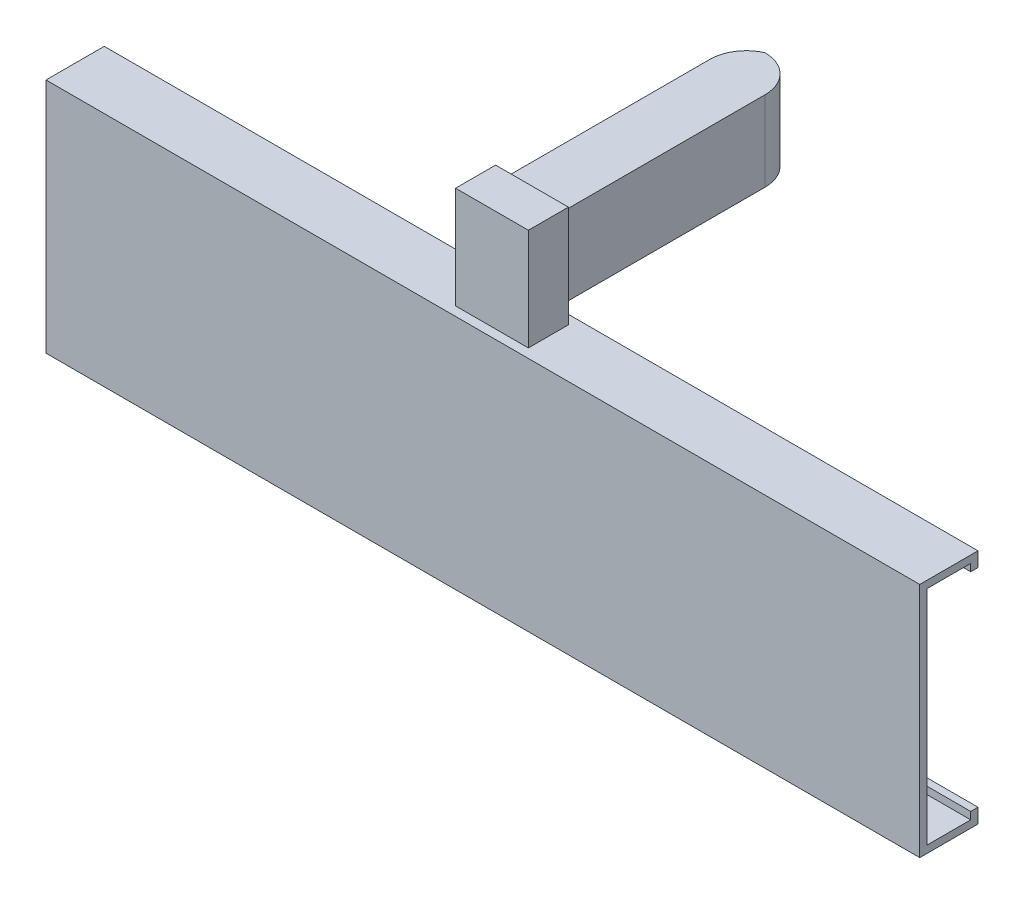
SolidWorks part; units mm, degrees
ref_plane "Front Plane" through (0, 0, 0) normal (0, 0, 1) x (1, 0, 0)
ref_plane "Top Plane" through (0, 0, 0) normal (0, 1, 0) x (1, 0, 0)
ref_plane "Right Plane" through (0, 0, 0) normal (1, 0, 0) x (0, 0, -1)
sketch "Sketch1" plane through (0, 0, 0) normal (0, 0, 1) x (1, 0, 0)
  line L1 (-60, -15.75) -> (60, -15.75)
  line L2 (-60, -15.75) -> (-60, 15.75)
  line L3 (-60, 15.75) -> (60, 15.75)
  line L4 (60, -15.75) -> (60, 15.75)
  line L5 (-60, -15.75) -> (60, 15.75) construction
  line L6 (-60, 15.75) -> (60, -15.75) construction
  point P0 (0, 0)
  dimension "D1" = 31.5
  dimension "D2" = 120
extrude "Boss-Extrude1" add sketch "Sketch1" along normal blind 1
sketch "Sketch2" plane through (0, 15.75, 0) normal (0, 1, 0) x (1, 0, 0)
  line L0 (60, -1) -> (-60, -1) construction
  line L1 (-60, 0) -> (60, 0)
  line L2 (-60, 0) -> (-60, 7)
  line L3 (-60, 7) -> (60, 7)
  line L4 (60, 0) -> (60, 7)
  line L5 (60, -1) -> (60, 0) construction
  dimension "D1" = 7
  dimension "D2" = 0
extrude "Boss-Extrude2" add sketch "Sketch2" against normal blind 1
sketch "Sketch3" plane through (0, 14.75, 0) normal (0, -1, 0) x (1, 0, 0)
  line L0 (60, 0) -> (60, -7) construction
  line L1 (-60, -7) -> (60, -7)
  line L2 (-60, -7) -> (-60, -6)
  line L3 (-60, -6) -> (60, -6)
  line L4 (60, -7) -> (60, -6)
  dimension "D1" = 1
extrude "Boss-Extrude3" add sketch "Sketch3" along normal blind 1
sketch "Sketch4" plane through (0, -15.75, 0) normal (0, -1, 0) x (1, 0, 0)
  line L1 (-60, 1) -> (60, 1)
  line L2 (-60, 1) -> (-60, -7)
  line L3 (-60, -7) -> (60, -7)
  line L4 (60, 1) -> (60, -7)
  line L8 (60, 1) -> (60, 0) construction
  dimension "D1" = 8
extrude "Boss-Extrude4" add sketch "Sketch4" along normal blind 1
sketch "Sketch6" plane through (0, -15.75, 0) normal (0, 1, 0) x (1, 0, 0)
  line L0 (60, 7) -> (60, 0) construction
  line L1 (-60, 7) -> (60, 7)
  line L2 (-60, 7) -> (-60, 6)
  line L3 (-60, 6) -> (60, 6)
  line L4 (60, 7) -> (60, 6)
  dimension "D1" = 1
extrude "Boss-Extrude5" add sketch "Sketch6" along normal blind 1
sketch "Sketch7" plane through (0, 15.75, 0) normal (0, 1, 0) x (1, 0, 0)
  line L0 (60, -1) -> (-60, -1) construction
  line L1 (-5.0011, 5.75) -> (4.9989, 5.75)
  line L2 (-5.0011, 5.75) -> (-5.0011, 0.25)
  line L3 (-5.0011, 0.25) -> (4.9989, 0.25)
  line L4 (4.9989, 5.75) -> (4.9989, 0.25)
  line L5 (-5.0011, 5.75) -> (4.9989, 0.25) construction
  line L6 (-5.0011, 0.25) -> (4.9989, 5.75) construction
  point P0 (-0.0011, 3)
  dimension "D1" = 10
  dimension "D2" = 5.5
  dimension "D3" = 4
extrude "Boss-Extrude6" add sketch "Sketch7" along normal blind 14
sketch "Sketch9" plane through (0, 0, -5.75) normal (0, 0, -1) x (-1, 0, 0)
  line L1 (-3.9989, 17.6137) -> (4.0011, 17.6137)
  line L2 (-3.9989, 17.6137) -> (-3.9989, 28.6137)
  line L3 (-3.9989, 28.6137) -> (4.0011, 28.6137)
  line L4 (4.0011, 17.6137) -> (4.0011, 28.6137)
  line L5 (-3.9989, 17.6137) -> (4.0011, 28.6137) construction
  line L6 (-3.9989, 28.6137) -> (4.0011, 17.6137) construction
  line L7 (-4.9989, 29.75) -> (-4.9989, 15.75) construction
  point P0 (0.0011, 23.1137)
  dimension "D1" = 8
  dimension "D2" = 11
  dimension "D3" = 1
extrude "Boss-Extrude7" add sketch "Sketch9" along normal blind 33
fillet "Fillet1" radius 5 1 edges at (3.9989, 23.1137, -38.75)
fillet "Fillet2" radius 5 1 edges at (-4.0011, 23.1137, -38.75)
